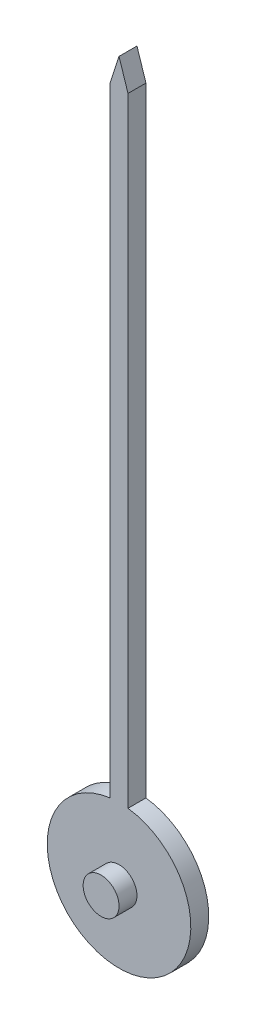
SolidWorks part; units mm, degrees
ref_plane "Plan de face" through (0, 0, 0) normal (0, 0, 1) x (1, 0, 0)
ref_plane "Plan de dessus" through (0, 0, 0) normal (0, 1, 0) x (1, 0, 0)
ref_plane "Plan de droite" through (0, 0, 0) normal (1, 0, 0) x (0, 0, -1)
sketch "Esquisse1" plane through (0, 0, 0) normal (0, 0, 1) x (1, 0, 0)
  line L0 (0, 42.6178) -> (0, -27.0987) construction
  line L1 (0, 40) -> (-0.5, 38.4613)
  line L2 (-0.5, 38.4613) -> (-0.5, 3.9686)
  line L4 (0.5, 38.4613) -> (0.5, 3.9686)
  line L5 (0, 40) -> (0.5, 38.4613)
  arc A0 (-0.5, 3.9686) -> (0.5, 3.9686) centre (0, 0) ccw
  dimension "D1" = 40
  dimension "D3" = 4
  dimension "D2" = 1
  dimension "D4" = 36.002
extrude "Boss.-Extru.1" add sketch "Esquisse1" along normal blind 1
sketch "Esquisse2" plane through (0, 0, 1) normal (0, 0, 1) x (1, 0, 0)
  circle A0 centre (0, 0) radius 1
  dimension "D1" = 2
extrude "Boss.-Extru.2" add sketch "Esquisse2" along normal blind 1
